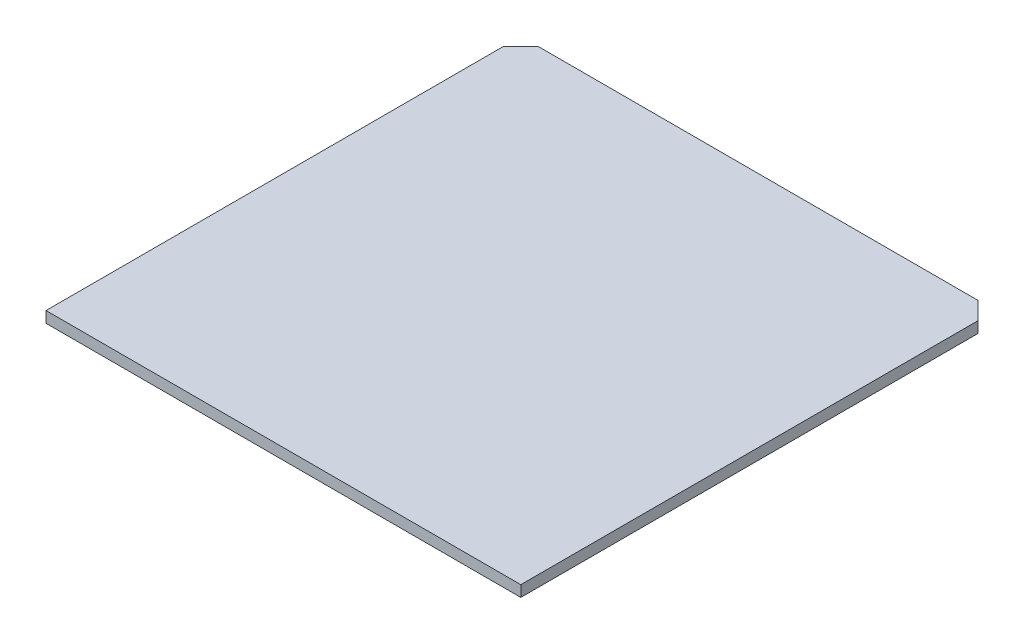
SolidWorks part; units mm, degrees
ref_plane "Front Plane" through (0, 0, 0) normal (0, 0, 1) x (1, 0, 0)
ref_plane "Top Plane" through (0, 0, 0) normal (0, 1, 0) x (1, 0, 0)
ref_plane "Right Plane" through (0, 0, 0) normal (1, 0, 0) x (0, 0, -1)
sketch "Sketch1" plane through (0, 0, 0) normal (0, 1, 0) x (1, 0, 0)
  line L1 (-34.29, 34.29) -> (34.29, 34.29)
  line L2 (-34.29, 34.29) -> (-34.29, -34.29)
  line L3 (-34.29, -34.29) -> (34.29, -34.29)
  line L4 (34.29, 34.29) -> (34.29, -34.29)
  line L5 (-34.29, 34.29) -> (34.29, -34.29) construction
  line L6 (-34.29, -34.29) -> (34.29, 34.29) construction
  point P0 (0, 0)
  dimension "D1" = 68.58
  dimension "D2" = 68.58
extrude "Boss-Extrude1" add sketch "Sketch1" along normal blind 1.6
chamfer "Chamfer1" distance 2.54 angle 45 2 edges at (34.29, 0.8, -34.29) (-34.29, 0.8, -34.29)
